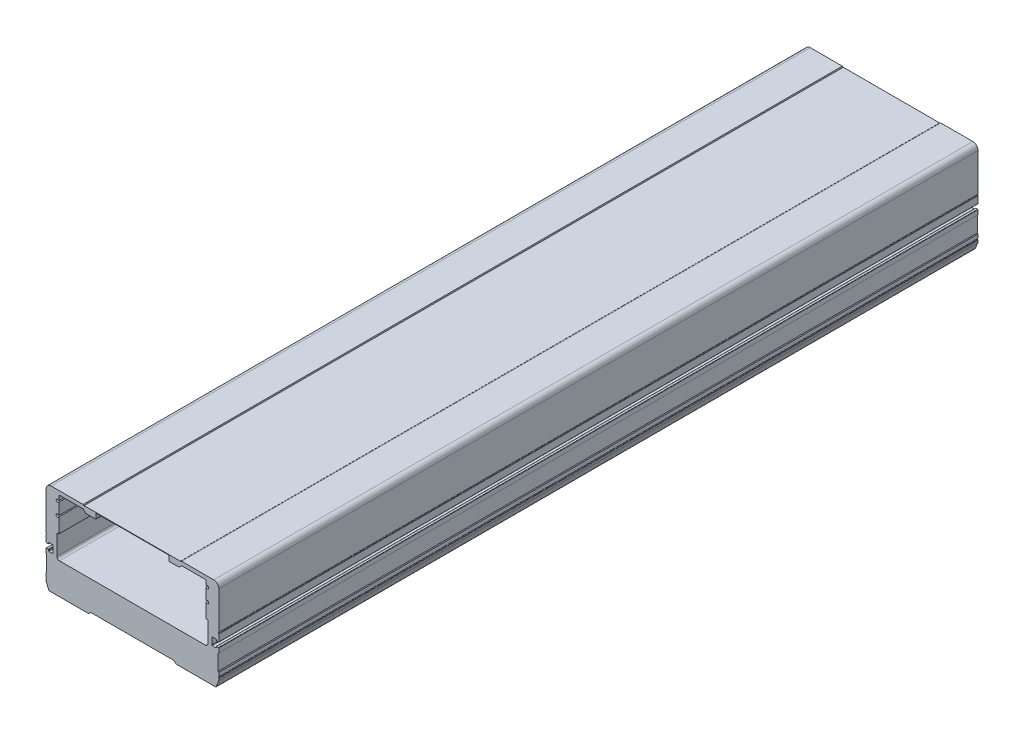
SolidWorks part; units mm, degrees
ref_plane "前视基准面" through (0, 0, 0) normal (0, 0, 1) x (1, 0, 0)
ref_plane "上视基准面" through (0, 0, 0) normal (0, 1, 0) x (1, 0, 0)
ref_plane "右视基准面" through (0, 0, 0) normal (1, 0, 0) x (0, 0, -1)
sketch "草图1" plane through (0, 0, 0) normal (0, 0, 1) x (1, 0, 0)
  line B0 (-57, 22.7) -> (57, 22.7)
  line B1 (-59, 40.3) -> (-59, 24.7)
  line B2 (-57.5, 40.6) -> (-59.3, 40.6)
  line B3 (-57.5, 52.1417) -> (-57.5, 40.6)
  line B4 (-57.5, 62.1417) -> (-57.5, 53.0583)
  line B5 (-57.5, 66.1) -> (-57.5, 63.0583)
  line B6 (-67.5, 66.1) -> (-67.5, 36.6047)
  line B7 (-67.5, 35.3953) -> (-67.5, 30.1)
  line B8 (-67.2, 29.8) -> (-65.8, 29.8)
  line B9 (-65.5, 30.1) -> (-65.5, 30.7)
  line B10 (-65.2, 31) -> (-62.3, 31)
  line B11 (-62, 30.7) -> (-62, 25.3)
  line B12 (-62.3, 25) -> (-65.2, 25)
  line B13 (-65.5, 25.3) -> (-65.5, 25.9)
  line B14 (-65.8, 26.2) -> (-67.2, 26.2)
  line B15 (-67.5, 25.9) -> (-67.5, 22.5)
  line B16 (-67.5, 22.5) -> (-67, 22)
  line B17 (-67, 22) -> (-67, 10)
  line B18 (-67, 10) -> (-67.5, 9.5)
  line B19 (-67.5, 9.5) -> (-67.5, 6.6047)
  line B20 (-67.5, 5.3953) -> (-67.5, 4.382)
  line B21 (-67.3592, 3.6449) -> (-65.5064, -1.0289)
  line B22 (-65.16, -1.6) -> (-34.1, -1.6)
  line B23 (-34.1, -1.6) -> (-32.5, 0)
  line B24 (-32.5, 0) -> (32.5, 0)
  line B25 (32.5, 0) -> (34.1, -1.6)
  line B26 (34.1, -1.6) -> (65.16, -1.6)
  line B27 (65.5064, -1.0289) -> (67.3592, 3.6449)
  line B28 (67.5, 4.382) -> (67.5, 5.3953)
  line B29 (67.5, 6.6047) -> (67.5, 9.5)
  line B30 (67.5, 9.5) -> (67, 10)
  line B31 (67, 10) -> (67, 22)
  line B32 (67, 22) -> (67.5, 22.5)
  line B33 (67.5, 22.5) -> (67.5, 25.9)
  line B34 (67.2, 26.2) -> (65.8, 26.2)
  line B35 (65.5, 25.9) -> (65.5, 25.3)
  line B36 (65.2, 25) -> (62.3, 25)
  line B37 (62, 25.3) -> (62, 30.7)
  line B38 (62.3, 31) -> (65.2, 31)
  line B39 (65.5, 30.7) -> (65.5, 30.1)
  line B40 (65.8, 29.8) -> (67.2, 29.8)
  line B41 (67.5, 30.1) -> (67.5, 35.3953)
  line B42 (67.5, 36.6047) -> (67.5, 66.1)
  line B43 (63.5, 70.1) -> (38.5, 70.1)
  line B44 (38.5, 70.1) -> (38, 69.6)
  line B45 (38, 69.6) -> (37.5, 69.6)
  line B46 (37.5, 69.6) -> (37.5, 69.7)
  line B47 (37.5, 69.7) -> (-37.5, 69.7)
  line B48 (-37.5, 69.7) -> (-37.5, 69.6)
  line B49 (-37.5, 69.6) -> (-38, 69.6)
  line B50 (-38, 69.6) -> (-38.5, 70.1)
  line B51 (-38.5, 70.1) -> (-63.5, 70.1)
  line B52 (-38.5, 67.1) -> (-56.5, 67.1)
  line B53 (-36.5, 65.1) -> (-38.5, 67.1)
  line B54 (-28.8, 65.1) -> (-36.5, 65.1)
  line B55 (-28.5, 69.3) -> (-28.5, 65.4)
  line B56 (28.5, 69.3) -> (-28.5, 69.3)
  line B57 (28.5, 65.4) -> (28.5, 69.3)
  line B58 (36.5, 65.1) -> (28.8, 65.1)
  line B59 (38.5, 67.1) -> (36.5, 65.1)
  line B60 (56.5, 67.1) -> (38.5, 67.1)
  line B61 (57.5, 63.0583) -> (57.5, 66.1)
  line B62 (57.5, 53.0583) -> (57.5, 62.1417)
  line B63 (57.5, 40.6) -> (57.5, 52.1417)
  line B64 (59, 40.6) -> (57.5, 40.6)
  line B65 (59, 24.7) -> (59, 40.6)
  arc B66 (-59, 24.7) -> (-57, 22.7) centre (-57, 24.7) ccw
  arc B67 (-59, 40.3) -> (-59.3, 40.6) centre (-59.3, 40.3) ccw
  arc B68 (-57.5, 53.0583) -> (-57.5, 52.1417) centre (-58.5, 52.6) ccw
  arc B69 (-57.5, 63.0583) -> (-57.5, 62.1417) centre (-58.5, 62.6) ccw
  arc B70 (-56.5, 67.1) -> (-57.5, 66.1) centre (-56.5, 66.1) ccw
  arc B71 (-28.8, 65.1) -> (-28.5, 65.4) centre (-28.8, 65.4) ccw
  arc B72 (28.5, 65.4) -> (28.8, 65.1) centre (28.8, 65.4) ccw
  arc B73 (57.5, 66.1) -> (56.5, 67.1) centre (56.5, 66.1) ccw
  arc B74 (57.5, 62.1417) -> (57.5, 63.0583) centre (58.5, 62.6) ccw
  arc B75 (57.5, 52.1417) -> (57.5, 53.0583) centre (58.5, 52.6) ccw
  arc B76 (57, 22.7) -> (59, 24.7) centre (57, 24.7) ccw
  arc B77 (-67.5, 36.6047) -> (-67.3333, 36.3359) centre (-67.2, 36.6047) ccw
  arc B78 (-67.3333, 35.6641) -> (-67.3333, 36.3359) centre (-67.5, 36) ccw
  arc B79 (-67.3333, 35.6641) -> (-67.5, 35.3953) centre (-67.2, 35.3953) ccw
  arc B80 (-67.5, 30.1) -> (-67.2, 29.8) centre (-67.2, 30.1) ccw
  arc B81 (-65.8, 29.8) -> (-65.5, 30.1) centre (-65.8, 30.1) ccw
  arc B82 (-65.2, 31) -> (-65.5, 30.7) centre (-65.2, 30.7) ccw
  arc B83 (-62, 30.7) -> (-62.3, 31) centre (-62.3, 30.7) ccw
  arc B84 (-62.3, 25) -> (-62, 25.3) centre (-62.3, 25.3) ccw
  arc B85 (-65.5, 25.3) -> (-65.2, 25) centre (-65.2, 25.3) ccw
  arc B86 (-65.5, 25.9) -> (-65.8, 26.2) centre (-65.8, 25.9) ccw
  arc B87 (-67.2, 26.2) -> (-67.5, 25.9) centre (-67.2, 25.9) ccw
  arc B88 (-67.5, 6.6047) -> (-67.3333, 6.3359) centre (-67.2, 6.6047) ccw
  arc B89 (-67.3333, 5.6641) -> (-67.3333, 6.3359) centre (-67.5, 6) ccw
  arc B90 (-67.3333, 5.6641) -> (-67.5, 5.3953) centre (-67.2, 5.3953) ccw
  arc B91 (-67.5, 4.382) -> (-67.3592, 3.6449) centre (-65.5, 4.382) ccw
  arc B92 (-65.5064, -1.0289) -> (-65.16, -1.6) centre (-63.6472, -0.2918) ccw
  arc B93 (65.16, -1.6) -> (65.5064, -1.0289) centre (63.6472, -0.2918) ccw
  arc B94 (67.3592, 3.6449) -> (67.5, 4.382) centre (65.5, 4.382) ccw
  arc B95 (67.5, 5.3953) -> (67.3333, 5.6641) centre (67.2, 5.3953) ccw
  arc B96 (67.3333, 6.3359) -> (67.3333, 5.6641) centre (67.5, 6) ccw
  arc B97 (67.3333, 6.3359) -> (67.5, 6.6047) centre (67.2, 6.6047) ccw
  arc B98 (67.5, 25.9) -> (67.2, 26.2) centre (67.2, 25.9) ccw
  arc B99 (65.8, 26.2) -> (65.5, 25.9) centre (65.8, 25.9) ccw
  arc B100 (65.2, 25) -> (65.5, 25.3) centre (65.2, 25.3) ccw
  arc B101 (62, 25.3) -> (62.3, 25) centre (62.3, 25.3) ccw
  arc B102 (62.3, 31) -> (62, 30.7) centre (62.3, 30.7) ccw
  arc B103 (65.5, 30.7) -> (65.2, 31) centre (65.2, 30.7) ccw
  arc B104 (65.5, 30.1) -> (65.8, 29.8) centre (65.8, 30.1) ccw
  arc B105 (67.2, 29.8) -> (67.5, 30.1) centre (67.2, 30.1) ccw
  arc B106 (67.5, 35.3953) -> (67.3333, 35.6641) centre (67.2, 35.3953) ccw
  arc B107 (67.3333, 36.3359) -> (67.3333, 35.6641) centre (67.5, 36) ccw
  arc B108 (67.3333, 36.3359) -> (67.5, 36.6047) centre (67.2, 36.6047) ccw
  arc B109 (67.5, 66.1) -> (63.5, 70.1) centre (63.5, 66.1) ccw
  arc B110 (-63.5, 70.1) -> (-67.5, 66.1) centre (-63.5, 66.1) ccw
sketch_block_instance "块1-1"
sketch_block "块1"
extrude "凸台-拉伸1" add sketch "草图1" along normal blind 593
hole_wizard "M6 螺纹孔1" positions "草图2" profile "草图3" tap size "M6" standard "GB"
sketch "草图2" plane through (0, -1.6, 0) normal (0, -1, 0) x (-1, 0, 0)
  line L0 (0, -593) -> (0, -464.3791) construction
  line L3 (32.5, -593) -> (-32.5, -593) construction
  line L4 (65.16, -593) -> (34.1, -593) construction
  point P0 (53, -541.5)
  point P9 (-53, -541.5)
  point P13 (53, -441.5)
  point P15 (53, -241.5)
  point P17 (53, -41.5)
  point P19 (53, 158.5)
  point P21 (53, 358.5)
  point P23 (53, 558.5)
  point P27 (-53, 358.5)
  point P28 (-53, 158.5)
  point P29 (-53, -41.5)
  point P30 (-53, -241.5)
  point P31 (-53, -441.5)
  point P38 (-53, 558.5)
  dimension "D1" = 106
  dimension "D2" = 51.5
  dimension "D3" = 100
  dimension "D4" = 200
  dimension "D5" = 200
  dimension "D6" = 200
  dimension "D7" = 200
  dimension "D8" = 200
sketch "草图3" plane through (-53, -1.6, 541.5) normal (1, 0, 0) x (0, 0, -1)
  line L0 (0, 0) -> (0, 13.5022)
  line L1 (0, 13.5022) -> (2.5, 12)
  line L2 (2.5, 12) -> (2.5, 0)
  line L5 (2.5, 0) -> (0, 0)
  line L10 (0, 13.5022) -> (-2.5, 12) construction
  line L11 (0, -6.35) -> (0, 107.95) construction
  dimension "螺纹孔钻头直径" = 5
  dimension "螺纹孔钻头深度" = 12
  dimension "导头角度" = 118
